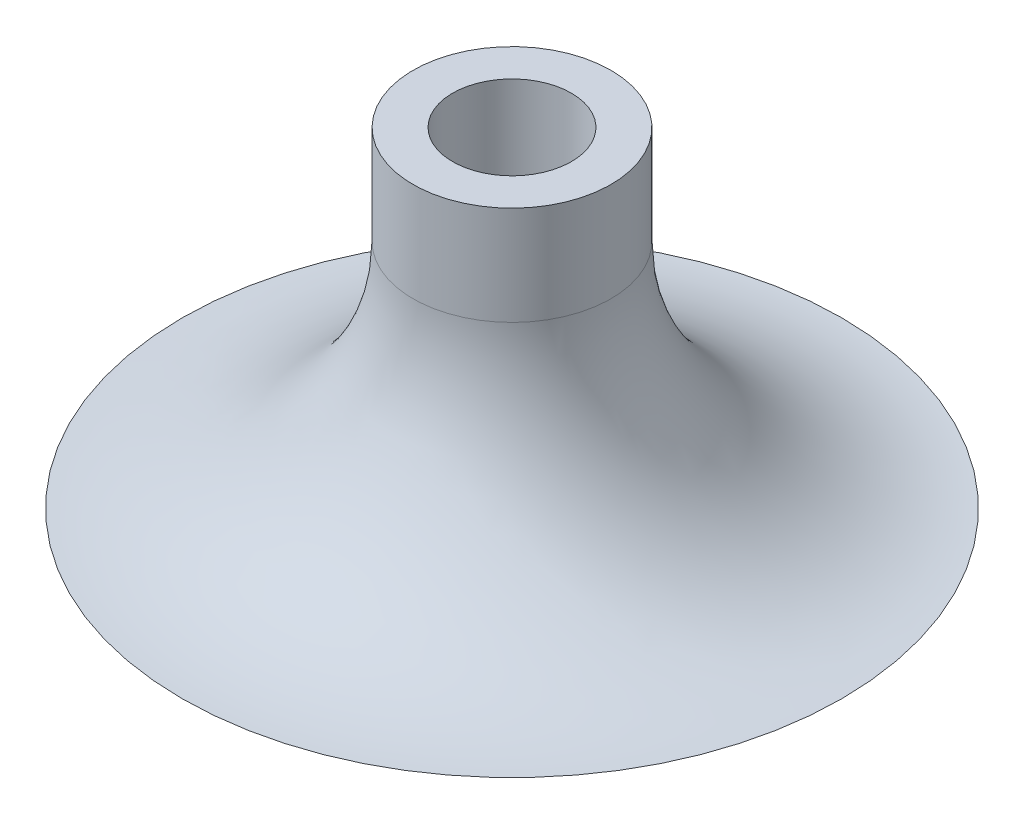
SolidWorks part; units mm, degrees
ref_plane "Front Plane" through (0, 0, 0) normal (0, 0, 1) x (1, 0, 0)
ref_plane "Top Plane" through (0, 0, 0) normal (0, 1, 0) x (1, 0, 0)
ref_plane "Right Plane" through (0, 0, 0) normal (1, 0, 0) x (0, 0, -1)
sketch "Sketch1" plane through (0, 0, 0) normal (1, 0, 0) x (0, 0, -1)
  line L0 (0, 0) -> (0, 86.8139) construction
  line L1 (-12.7, 3.81) -> (-2.286, 3.81)
  line L2 (-3.81, 12.7) -> (-3.81, 16.51)
  line L3 (-3.81, 16.51) -> (-2.286, 16.51)
  line L4 (-2.286, 16.51) -> (-2.286, 3.81)
  arc A0 (-3.81, 12.7) -> (-12.7, 3.81) centre (-12.7, 12.7) cw
  dimension "D1" = 8.89
  dimension "D2" = 1.524
  dimension "D3" = 12.7
  dimension "D4" = 3.81
revolve "Revolve1" add sketch "Sketch1" angle 360 about L0
